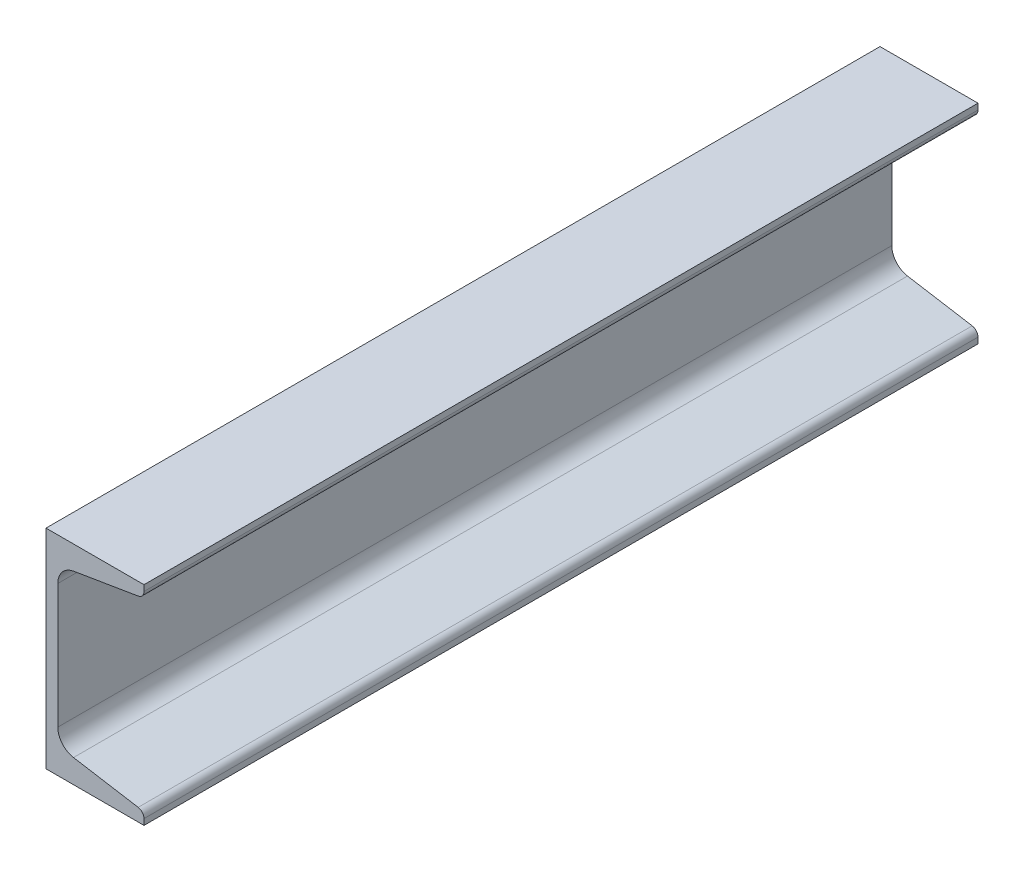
SolidWorks part; units mm, degrees
ref_plane "FRONT" through (0, 0, 0) normal (0, 0, 1) x (1, 0, 0)
ref_plane "TOP" through (0, 0, 0) normal (0, 1, 0) x (-1, 0, 0)
ref_plane "RIGHT" through (0, 0, 0) normal (1, 0, 0) x (0, 0, -1)
sketch "Sketch1" plane through (0, 0, 0) normal (0, 0, 1) x (1, 0, 0)
  line L0 (0, 0) -> (0, 76.2)
  line L1 (0, 76.2) -> (35.814, 76.2)
  line L2 (0, 0) -> (35.814, 0)
  line L3 (19.6977, 0) -> (-19.6977, 0) construction
  line L4 (0, -41.91) -> (0, 41.91) construction
  line L12 (4.318, 60.8326) -> (4.318, 15.3674)
  line L15 (35.814, 76.2) -> (35.814, 74.0435)
  line L16 (35.814, 0) -> (35.814, 2.1565)
  line L17 (10.0485, 67.5973) -> (33.6916, 71.5381)
  line L18 (10.0485, 8.6027) -> (33.6916, 4.6619)
  arc A9 (4.318, 15.3674) -> (10.0485, 8.6027) centre (11.176, 15.3674) ccw
  arc A10 (4.318, 60.8326) -> (10.0485, 67.5973) centre (11.176, 60.8326) cw
  arc A11 (35.814, 74.0435) -> (33.6916, 71.5381) centre (33.274, 74.0435) cw
  arc A12 (35.814, 2.1565) -> (33.6916, 4.6619) centre (33.274, 2.1565) ccw
  point P8 (35.814, 71.8919)
  dimension "RI" = 6.858
  dimension "D2" = 9.463
  dimension "RA" = 2.54
  dimension "Depth" = 76.2
  dimension "BF" = 35.814
  dimension "TW" = 4.318
  dimension "D1" = 2.1565
extrude "BaseChannel" add sketch "Sketch1" along normal mid plane 304.8
